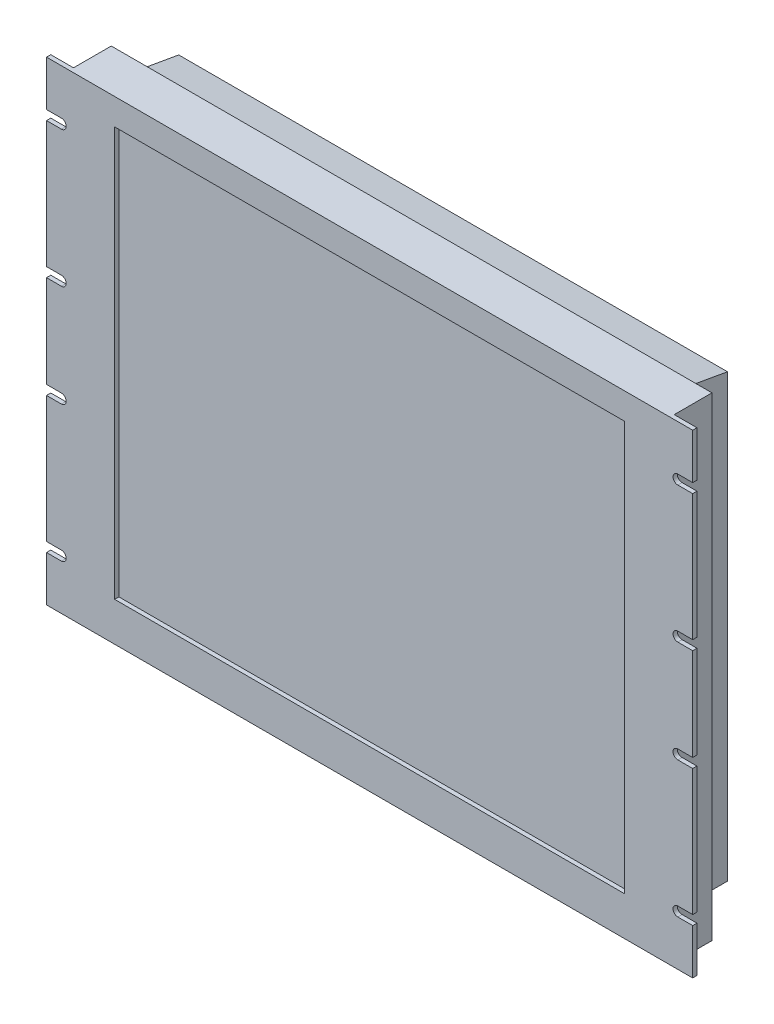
SolidWorks part; units mm, degrees
ref_plane "Front Plane" through (0, 0, 0) normal (0, 0, 1) x (1, 0, 0)
ref_plane "Top Plane" through (0, 0, 0) normal (0, 1, 0) x (1, 0, 0)
ref_plane "Right Plane" through (0, 0, 0) normal (1, 0, 0) x (0, 0, -1)
sketch "Sketch1" plane through (0, 0, 0) normal (0, 0, 1) x (1, 0, 0)
  line L0 (241.3, 177.165) -> (-241.3, 177.165)
  line L1 (241.3, -177.165) -> (-241.3, -177.165)
  line L2 (-190.4238, 157.5054) -> (-190.4238, -148.1074)
  line L3 (-190.4238, -148.1074) -> (190.4238, -148.1074)
  line L4 (190.4238, -148.1074) -> (190.4238, 157.5054)
  line L5 (190.4238, 157.5054) -> (-190.4238, 157.5054)
  line L6 (-230.1759, 143.256) -> (-241.3, 143.256)
  line L7 (-230.1759, 136.144) -> (-241.3, 136.144)
  line L8 (-241.3, 177.165) -> (-241.3, 143.256)
  line L9 (-230.1759, 41.656) -> (-241.3, 41.656)
  line L10 (-230.1759, 34.544) -> (-241.3, 34.544)
  line L11 (-230.1759, -34.544) -> (-241.3, -34.544)
  line L12 (-230.1759, -41.656) -> (-241.3, -41.656)
  line L13 (-230.1759, -136.144) -> (-241.3, -136.144)
  line L14 (-230.1759, -143.256) -> (-241.3, -143.256)
  line L15 (-241.3, 136.144) -> (-241.3, 41.656)
  line L16 (-241.3, 34.544) -> (-241.3, -34.544)
  line L17 (-241.3, -41.656) -> (-241.3, -136.144)
  line L18 (-241.3, -143.256) -> (-241.3, -177.165)
  line L19 (230.1759, 143.256) -> (241.3, 143.256)
  line L20 (230.1759, 136.144) -> (241.3, 136.144)
  line L21 (230.1759, 41.656) -> (241.3, 41.656)
  line L22 (230.1759, 34.544) -> (241.3, 34.544)
  line L23 (230.1759, -34.544) -> (241.3, -34.544)
  line L24 (230.1759, -41.656) -> (241.3, -41.656)
  line L25 (230.1759, -136.144) -> (241.3, -136.144)
  line L26 (230.1759, -143.256) -> (241.3, -143.256)
  line L27 (241.3, 177.165) -> (241.3, 143.256)
  line L28 (241.3, 136.144) -> (241.3, 41.656)
  line L29 (241.3, 34.544) -> (241.3, -34.544)
  line L30 (241.3, -41.656) -> (241.3, -136.144)
  line L31 (241.3, -143.256) -> (241.3, -177.165)
  arc A0 (-230.1759, 136.144) -> (-230.1759, 143.256) centre (-230.1759, 139.7) ccw
  arc A1 (-230.1759, 34.544) -> (-230.1759, 41.656) centre (-230.1759, 38.1) ccw
  arc A2 (-230.1759, -41.656) -> (-230.1759, -34.544) centre (-230.1759, -38.1) ccw
  arc A3 (-230.1759, -143.256) -> (-230.1759, -136.144) centre (-230.1759, -139.7) ccw
  arc A4 (230.1759, 143.256) -> (230.1759, 136.144) centre (230.1759, 139.7) ccw
  arc A5 (230.1759, 41.656) -> (230.1759, 34.544) centre (230.1759, 38.1) ccw
  arc A6 (230.1759, -34.544) -> (230.1759, -41.656) centre (230.1759, -38.1) ccw
  arc A7 (230.1759, -136.144) -> (230.1759, -143.256) centre (230.1759, -139.7) ccw
  point P49 (0, 177.165)
  point P50 (-241.3, 0)
extrude "Boss-Extrude1" add sketch "Sketch1" along normal blind 3.175
sketch "Sketch2" plane through (0, 0, 0) normal (0, 0, -1) x (-1, 0, 0)
  line L0 (241.3, 177.165) -> (241.3, 143.256) construction
  line L1 (241.3, -177.165) -> (-241.3, -177.165) construction
  line L3 (224.3328, 177.165) -> (224.3328, -177.165)
  line L4 (-224.3328, 177.165) -> (-224.3328, -177.165)
  line L5 (-224.3328, 177.165) -> (224.3328, 177.165)
  line L6 (-224.3328, -177.165) -> (224.3328, -177.165)
  line L7 (-241.3, 177.165) -> (241.3, 177.165) construction
  point P0 (0, 177.165)
  dimension "D1" = 448.6656
extrude "Boss-Extrude2" add sketch "Sketch2" along normal blind 28.194
sketch "Sketch3" plane through (0, 0, -28.194) normal (0, 0, -1) x (-1, 0, 0)
  line L0 (-204.9209, -163.9056) -> (-204.9209, 171.069)
  line L1 (-21.5907, -163.9056) -> (-204.9209, -163.9056)
  line L2 (204.9209, 171.069) -> (204.9209, -52.4581)
  line L3 (-21.5907, -52.4581) -> (-21.5907, -163.9056)
  line L4 (-21.5907, -52.4581) -> (204.9209, -52.4581)
  line L117 (204.9209, 171.069) -> (-204.9209, 171.069)
  line L119 (-224.3328, -177.165) -> (-241.3, -177.165) construction
  line L120 (-224.3328, 177.165) -> (-224.3328, -177.165) construction
  line L121 (224.3328, 177.165) -> (-224.3328, 177.165) construction
  dimension "D1" = 13.2594
  dimension "D2" = 19.4119
  dimension "D3" = 202.7421
  dimension "D4" = 429.2537
  dimension "D5" = 6.096
  dimension "D6" = 229.6231
extrude "Boss-Extrude3" add sketch "Sketch3" along normal offset from surface (30.988 mm away) 59.182
draft "Draft3" type of draft neutral plane draft angle 10 faces to draft 1 parameters "D1"=10
sketch "Sketch4" plane through (0, 0, -59.182) normal (0, 0, -1) x (-1, 0, 0)
  circle A1 centre (130.5626, 132.6166) radius 1.9812
  circle A2 centre (98.8009, 132.6166) radius 7.1374
  circle A3 centre (80.7669, 132.6166) radius 7.1374
  circle A4 centre (62.7329, 132.6166) radius 7.1374
  circle A5 centre (44.6989, 132.6166) radius 7.1374
  circle A7 centre (116.8349, 132.6166) radius 7.1374
extrude "Boss-Extrude4" add sketch "Sketch4" along normal blind 0.508
sketch "Sketch5" plane through (0, 0, -59.182) normal (0, 0, -1) x (-1, 0, 0)
  line L1 (-166.0241, -133.1031) -> (-166.0241, -120.4031)
  line L2 (-168.5641, -120.4031) -> (-168.5641, -133.1031)
  line L3 (-166.0241, -120.4031) -> (-168.5641, -120.4031)
  line L4 (-166.0241, -133.1031) -> (-168.5641, -133.1031)
  line L5 (-159.6741, -133.1031) -> (-159.6741, -120.4031)
  line L6 (-162.2141, -120.4031) -> (-162.2141, -133.1031)
  line L7 (-159.6741, -120.4031) -> (-162.2141, -120.4031)
  line L8 (-159.6741, -133.1031) -> (-162.2141, -133.1031)
  line L9 (-153.3241, -133.1031) -> (-153.3241, -120.4031)
  line L10 (-155.8641, -120.4031) -> (-155.8641, -133.1031)
  line L11 (-153.3241, -120.4031) -> (-155.8641, -120.4031)
  line L12 (-153.3241, -133.1031) -> (-155.8641, -133.1031)
  line L13 (-146.9741, -133.1031) -> (-146.9741, -120.4031)
  line L14 (-149.5141, -120.4031) -> (-149.5141, -133.1031)
  line L15 (-146.9741, -120.4031) -> (-149.5141, -120.4031)
  line L16 (-146.9741, -133.1031) -> (-149.5141, -133.1031)
  line L17 (-140.6241, -133.1031) -> (-140.6241, -120.4031)
  line L18 (-143.1641, -120.4031) -> (-143.1641, -133.1031)
  line L19 (-140.6241, -120.4031) -> (-143.1641, -120.4031)
  line L20 (-140.6241, -133.1031) -> (-143.1641, -133.1031)
  line L21 (-134.2741, -133.1031) -> (-134.2741, -120.4031)
  line L22 (-136.8141, -120.4031) -> (-136.8141, -133.1031)
  line L23 (-134.2741, -120.4031) -> (-136.8141, -120.4031)
  line L24 (-134.2741, -133.1031) -> (-136.8141, -133.1031)
  line L25 (-127.9241, -133.1031) -> (-127.9241, -120.4031)
  line L26 (-130.4641, -120.4031) -> (-130.4641, -133.1031)
  line L27 (-127.9241, -120.4031) -> (-130.4641, -120.4031)
  line L28 (-127.9241, -133.1031) -> (-130.4641, -133.1031)
  line L29 (-121.5741, -133.1031) -> (-121.5741, -120.4031)
  line L30 (-124.1141, -120.4031) -> (-124.1141, -133.1031)
  line L31 (-121.5741, -120.4031) -> (-124.1141, -120.4031)
  line L32 (-121.5741, -133.1031) -> (-124.1141, -133.1031)
  line L33 (-172.3741, -133.1031) -> (-172.3741, -120.4031)
  line L34 (-174.9141, -120.4031) -> (-174.9141, -133.1031)
  line L35 (-172.3741, -120.4031) -> (-174.9141, -120.4031)
  line L36 (-172.3741, -133.1031) -> (-174.9141, -133.1031)
  line L37 (-178.7241, -133.1031) -> (-178.7241, -120.4031)
  line L38 (-181.2641, -120.4031) -> (-181.2641, -133.1031)
  line L39 (-178.7241, -120.4031) -> (-181.2641, -120.4031)
  line L40 (-178.7241, -133.1031) -> (-181.2641, -133.1031)
  line L41 (-185.0741, -133.1031) -> (-185.0741, -120.4031)
  line L42 (-187.6141, -120.4031) -> (-187.6141, -133.1031)
  line L43 (-185.0741, -120.4031) -> (-187.6141, -120.4031)
  line L44 (-185.0741, -133.1031) -> (-187.6141, -133.1031)
  line L45 (-166.0241, -152.1531) -> (-166.0241, -139.4531)
  line L46 (-168.5641, -139.4531) -> (-168.5641, -152.1531)
  line L47 (-166.0241, -139.4531) -> (-168.5641, -139.4531)
  line L48 (-166.0241, -152.1531) -> (-168.5641, -152.1531)
  line L49 (-159.6741, -152.1531) -> (-159.6741, -139.4531)
  line L50 (-162.2141, -139.4531) -> (-162.2141, -152.1531)
  line L51 (-159.6741, -139.4531) -> (-162.2141, -139.4531)
  line L52 (-159.6741, -152.1531) -> (-162.2141, -152.1531)
  line L53 (-153.3241, -152.1531) -> (-153.3241, -139.4531)
  line L54 (-155.8641, -139.4531) -> (-155.8641, -152.1531)
  line L55 (-153.3241, -139.4531) -> (-155.8641, -139.4531)
  line L56 (-153.3241, -152.1531) -> (-155.8641, -152.1531)
  line L57 (-146.9741, -152.1531) -> (-146.9741, -139.4531)
  line L58 (-149.5141, -139.4531) -> (-149.5141, -152.1531)
  line L59 (-146.9741, -139.4531) -> (-149.5141, -139.4531)
  line L60 (-146.9741, -152.1531) -> (-149.5141, -152.1531)
  line L61 (-140.6241, -152.1531) -> (-140.6241, -139.4531)
  line L62 (-143.1641, -139.4531) -> (-143.1641, -152.1531)
  line L63 (-140.6241, -139.4531) -> (-143.1641, -139.4531)
  line L64 (-140.6241, -152.1531) -> (-143.1641, -152.1531)
  line L65 (-134.2741, -152.1531) -> (-134.2741, -139.4531)
  line L66 (-136.8141, -139.4531) -> (-136.8141, -152.1531)
  line L67 (-134.2741, -139.4531) -> (-136.8141, -139.4531)
  line L68 (-134.2741, -152.1531) -> (-136.8141, -152.1531)
  line L69 (-127.9241, -152.1531) -> (-127.9241, -139.4531)
  line L70 (-130.4641, -139.4531) -> (-130.4641, -152.1531)
  line L71 (-127.9241, -139.4531) -> (-130.4641, -139.4531)
  line L72 (-127.9241, -152.1531) -> (-130.4641, -152.1531)
  line L73 (-121.5741, -152.1531) -> (-121.5741, -139.4531)
  line L74 (-124.1141, -139.4531) -> (-124.1141, -152.1531)
  line L75 (-121.5741, -139.4531) -> (-124.1141, -139.4531)
  line L76 (-121.5741, -152.1531) -> (-124.1141, -152.1531)
  line L77 (-172.3741, -152.1531) -> (-172.3741, -139.4531)
  line L78 (-174.9141, -139.4531) -> (-174.9141, -152.1531)
  line L79 (-172.3741, -139.4531) -> (-174.9141, -139.4531)
  line L80 (-172.3741, -152.1531) -> (-174.9141, -152.1531)
  line L81 (-178.7241, -152.1531) -> (-178.7241, -139.4531)
  line L82 (-181.2641, -139.4531) -> (-181.2641, -152.1531)
  line L83 (-178.7241, -139.4531) -> (-181.2641, -139.4531)
  line L84 (-178.7241, -152.1531) -> (-181.2641, -152.1531)
  line L85 (-185.0741, -152.1531) -> (-185.0741, -139.4531)
  line L86 (-187.6141, -139.4531) -> (-187.6141, -152.1531)
  line L87 (-185.0741, -139.4531) -> (-187.6141, -139.4531)
  line L88 (-185.0741, -152.1531) -> (-187.6141, -152.1531)
  line L89 (-115.2241, -133.1031) -> (-115.2241, -120.4031)
  line L90 (-117.7641, -120.4031) -> (-117.7641, -133.1031)
  line L91 (-115.2241, -120.4031) -> (-117.7641, -120.4031)
  line L92 (-115.2241, -133.1031) -> (-117.7641, -133.1031)
  line L93 (-108.8741, -133.1031) -> (-108.8741, -120.4031)
  line L94 (-111.4141, -120.4031) -> (-111.4141, -133.1031)
  line L95 (-108.8741, -120.4031) -> (-111.4141, -120.4031)
  line L96 (-108.8741, -133.1031) -> (-111.4141, -133.1031)
  line L97 (-115.2241, -152.1531) -> (-115.2241, -139.4531)
  line L98 (-117.7641, -139.4531) -> (-117.7641, -152.1531)
  line L99 (-115.2241, -139.4531) -> (-117.7641, -139.4531)
  line L100 (-115.2241, -152.1531) -> (-117.7641, -152.1531)
  line L101 (-108.8741, -152.1531) -> (-108.8741, -139.4531)
  line L102 (-111.4141, -139.4531) -> (-111.4141, -152.1531)
  line L103 (-108.8741, -139.4531) -> (-111.4141, -139.4531)
  line L104 (-108.8741, -152.1531) -> (-111.4141, -152.1531)
  line L105 (-102.5241, -133.1031) -> (-102.5241, -120.4031)
  line L106 (-105.0641, -120.4031) -> (-105.0641, -133.1031)
  line L107 (-102.5241, -120.4031) -> (-105.0641, -120.4031)
  line L108 (-102.5241, -133.1031) -> (-105.0641, -133.1031)
  line L109 (-102.5241, -152.1531) -> (-102.5241, -139.4531)
  line L110 (-105.0641, -139.4531) -> (-105.0641, -152.1531)
  line L111 (-102.5241, -139.4531) -> (-105.0641, -139.4531)
  line L112 (-102.5241, -152.1531) -> (-105.0641, -152.1531)
  point P114 (-167.2941, -133.1031)
  point P115 (-167.2941, -120.4031)
  point P116 (-160.9441, -133.1031)
  point P117 (-160.9441, -120.4031)
  point P118 (-154.5941, -133.1031)
  point P119 (-154.5941, -120.4031)
  point P120 (-148.2441, -133.1031)
  point P121 (-148.2441, -120.4031)
  point P122 (-141.8941, -133.1031)
  point P123 (-141.8941, -120.4031)
  point P124 (-135.5441, -133.1031)
  point P125 (-135.5441, -120.4031)
  point P126 (-129.1941, -133.1031)
  point P127 (-129.1941, -120.4031)
  point P128 (-122.8441, -133.1031)
  point P129 (-122.8441, -120.4031)
  point P130 (-173.6441, -133.1031)
  point P131 (-173.6441, -120.4031)
  point P132 (-179.9941, -133.1031)
  point P133 (-179.9941, -120.4031)
  point P134 (-186.3441, -133.1031)
  point P135 (-186.3441, -120.4031)
  point P136 (-167.2941, -152.1531)
  point P137 (-167.2941, -139.4531)
  point P138 (-160.9441, -152.1531)
  point P139 (-160.9441, -139.4531)
  point P140 (-154.5941, -152.1531)
  point P141 (-154.5941, -139.4531)
  point P142 (-148.2441, -152.1531)
  point P143 (-148.2441, -139.4531)
  point P144 (-141.8941, -152.1531)
  point P145 (-141.8941, -139.4531)
  point P146 (-135.5441, -152.1531)
  point P147 (-135.5441, -139.4531)
  point P148 (-129.1941, -152.1531)
  point P149 (-129.1941, -139.4531)
  point P150 (-122.8441, -152.1531)
  point P151 (-122.8441, -139.4531)
  point P152 (-173.6441, -152.1531)
  point P153 (-173.6441, -139.4531)
  point P154 (-179.9941, -152.1531)
  point P155 (-179.9941, -139.4531)
  point P156 (-186.3441, -152.1531)
  point P157 (-186.3441, -139.4531)
  point P158 (-116.4941, -133.1031)
  point P159 (-116.4941, -120.4031)
  point P160 (-110.1441, -133.1031)
  point P161 (-110.1441, -120.4031)
  point P162 (-116.4941, -152.1531)
  point P163 (-116.4941, -139.4531)
  point P164 (-110.1441, -152.1531)
  point P165 (-110.1441, -139.4531)
  point P166 (-103.7941, -133.1031)
  point P167 (-103.7941, -120.4031)
  point P168 (-103.7941, -152.1531)
  point P169 (-103.7941, -139.4531)
extrude "Cut-Extrude1" cut sketch "Sketch5" against normal blind 1.524
